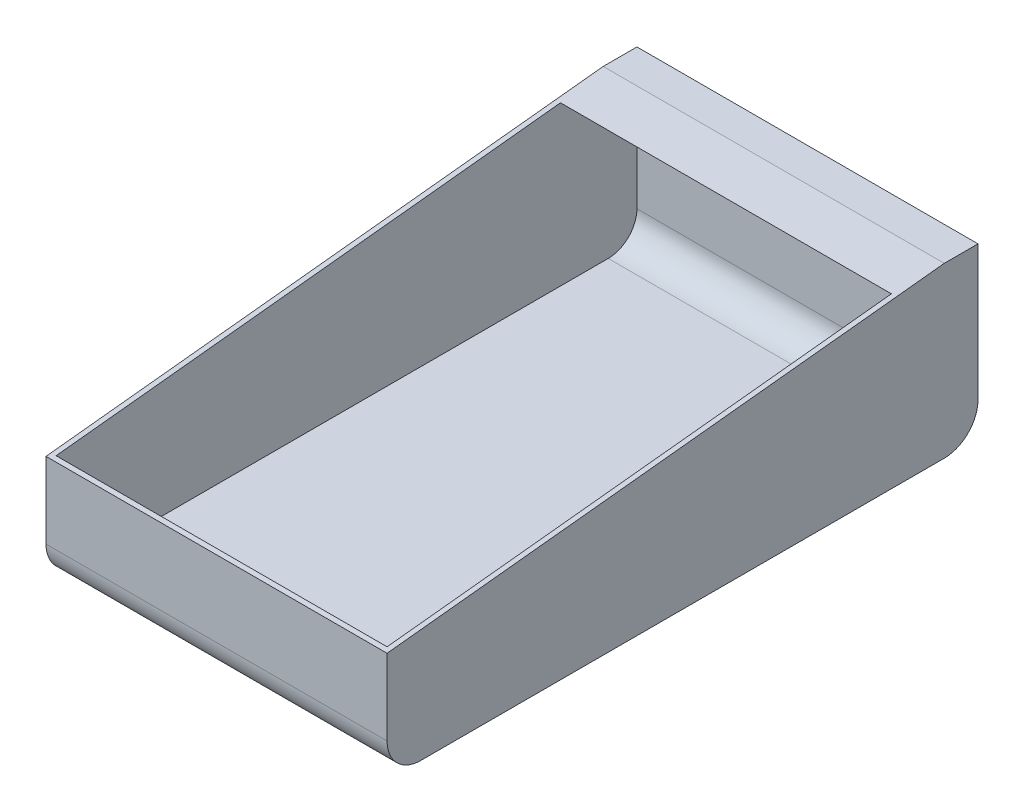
SolidWorks part; units mm, degrees
ref_plane "Front Plane" through (0, 0, 0) normal (0, 0, 1) x (1, 0, 0)
ref_plane "Top Plane" through (0, 0, 0) normal (0, 1, 0) x (1, 0, 0)
ref_plane "Right Plane" through (0, 0, 0) normal (1, 0, 0) x (0, 0, -1)
sketch "Sketch1" plane through (0, 0, 0) normal (0, 1, 0) x (1, 0, 0)
  line L1 (-101, 175) -> (101, 175)
  line L2 (-101, 175) -> (-101, -175)
  line L3 (-101, -175) -> (101, -175)
  line L4 (101, 175) -> (101, -175)
  line L5 (-101, 175) -> (101, -175) construction
  line L6 (-101, -175) -> (101, 175) construction
  point P0 (0, 0)
  dimension "D1" = 350
  dimension "D2" = 202
extrude "Boss-Extrude1" add sketch "Sketch1" along normal blind 100
chamfer "Chamfer1" distance 35 distance2 330 1 edges at (0, 100, 175)
fillet "Fillet1" radius 20 1 edges at (0, 0, 175)
fillet "Fillet2" radius 20 1 edges at (0, 0, -175)
shell "Shell2" thickness 3
